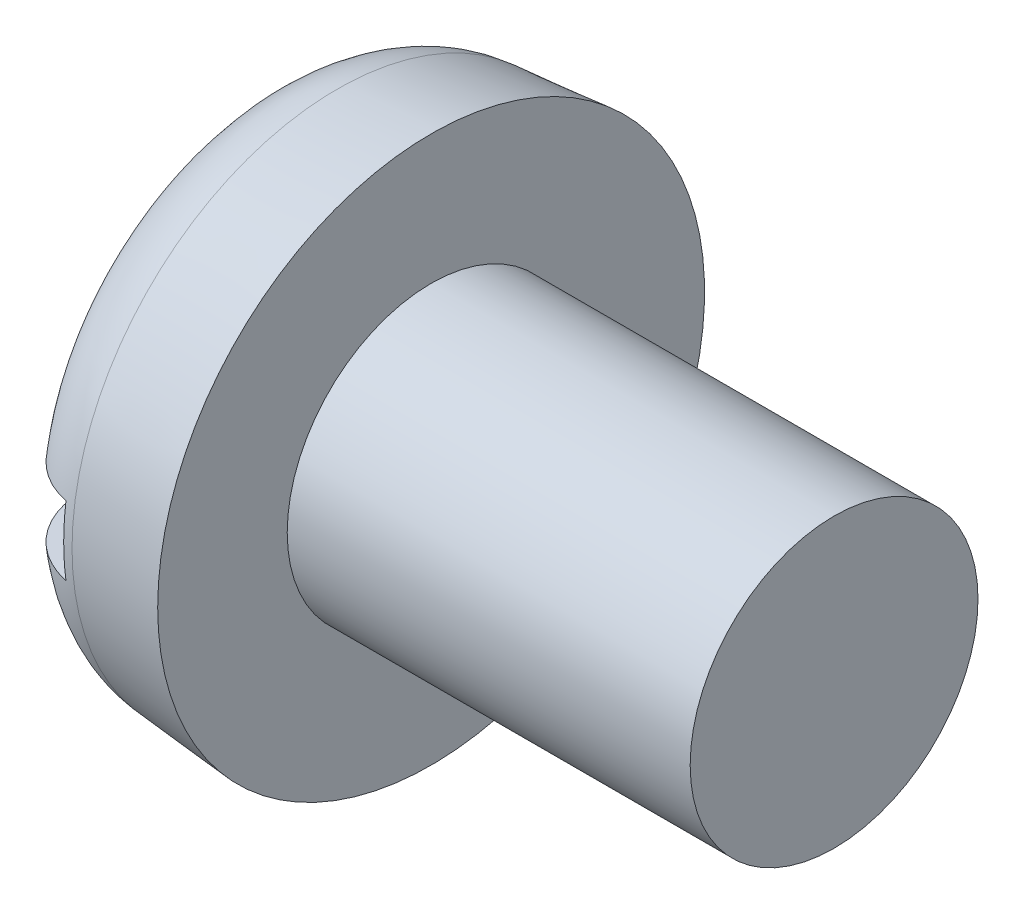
SolidWorks part; units mm, degrees
ref_plane "Plane1" through (0, 0, 0) normal (0, 0, 1) x (1, 0, 0)
ref_plane "Plane2" through (0, 0, 0) normal (0, 1, 0) x (1, 0, 0)
ref_plane "Plane3" through (0, 0, 0) normal (1, 0, 0) x (0, 0, -1)
sketch "BodySke" plane through (0, 0, 0) normal (0, 0, 1) x (1, 0, 0)
  line L0 (3, 2.5) -> (3, 4.75)
  line L1 (0, 0) -> (0, 4.4875)
  line L2 (-25.4, 0) -> (127, 0) construction
  line L3 (10, 0) -> (0, 0)
  line L4 (3, 2.5) -> (10, 2.5)
  line L5 (10, 2.5) -> (10, 0)
  line L6 (0, 4.4875) -> (3, 4.75)
  line L9 (3.8, 4.0875) -> (3.8, -5.4375) construction
  line L10 (3, 6.35) -> (3, -3.175) construction
  dimension "Head_ht" = 3
  dimension "Diameter" = 5
  dimension "Length" = 7
  dimension "Head_dia" = 9.5
  dimension "Advance" = 0.8
  dimension "Thread_nom" = 7
  dimension "Head_side_angle" = 5
revolve "Base-Revolve" add sketch "BodySke"
fillet "Fillet1" [suppressed] radius 0.2
fillet "Fillet2" radius 1.5 1 edges at (0, 0, 4.4875)
sketch "Sketch2" plane through (0, 0, 0) normal (1, 0, 0) x (0, 0, -1)
  line L0 (4.75, -0.6) -> (-4.75, -0.6)
  line L1 (4.75, -0.6) -> (4.75, 0.6)
  line L2 (-4.75, 0.6) -> (4.75, 0.6)
  line L3 (-4.75, 0.6) -> (-4.75, -0.6)
  dimension "D1" = 9.5
  dimension "D2" = 4.75
  dimension "Slot_width" = 1.2
  dimension "D3" = 0.6
extrude "Slot" cut sketch "Sketch2" along normal blind 1.2
sketch "ThdSchSke" plane through (0, 0, 0) normal (0, 0, 1) x (1, 0, 0)
  line L0 (4.6, -2.055) -> (4.2884, -2.5)
  line L1 (4.6, -2.055) -> (4.9116, -2.5)
  line L2 (4.9116, -2.5) -> (4.9116, -3.125)
  line L3 (-3.175, 0) -> (5.1513, 0) construction
  line L5 (4.9116, -3.125) -> (4.2884, -3.125)
  line L6 (4.2884, -3.125) -> (4.2884, -2.5)
  dimension "Thread_minor" = 4.11
  dimension "Diameter" = 5
  dimension "Start" = 4.6
  dimension "SideAngle" = 55
  dimension "VeeAngle" = 70
  dimension "Overcut" = 6.25
revolve "ThreadSchematic" [suppressed] cut sketch "ThdSchSke" angle 360 about L3
pattern_linear "ThdSchPat" [suppressed]
equation "\"D1@Sketch2\" = \"Head_dia@BodySke\""
equation "\"D2@Sketch2\" = \"D1@Sketch2\" / 2"
equation "\"D3@Sketch2\" = \"Slot_width@Sketch2\" / 2"
equation "\"Thread_length@ThreadCosmetic\" = ((sgn( (\"Length@BodySke\" - \"Advance@BodySke\" * 2.0 ) - \"Thread_nom@BodySke\" )-1)*( (\"Length@BodySke\" - \"Advance@BodySke\"  * 2.0) - \"Thread_nom@BodySke\" ))/-2+ \"Thread_"
equation "\"Thread_minor@ThdSchSke\" = \"Thread_minor@ThreadCosmetic\""
equation "\"Diameter@ThdSchSke\" = \"Diameter@BodySke\""
equation "\"Overcut@ThdSchSke\" = \"Diameter@BodySke\" * 1.25"
equation "\"Start@ThdSchSke\" = \"Head_ht@BodySke\" + \"Length@BodySke\" - \"Thread_length@ThreadCosmetic\"  '---Non-countersunk---"
equation "\"Num_threads@ThdSchPat\" = int( \"Thread_length@ThreadCosmetic\" / \"Advance@BodySke\" + 0.999 )  + 1"
equation "\"Advance@ThdSchPat\" = \"Thread_length@ThreadCosmetic\" /  (\"Num_threads@ThdSchPat\" - 1) 'relax it"
